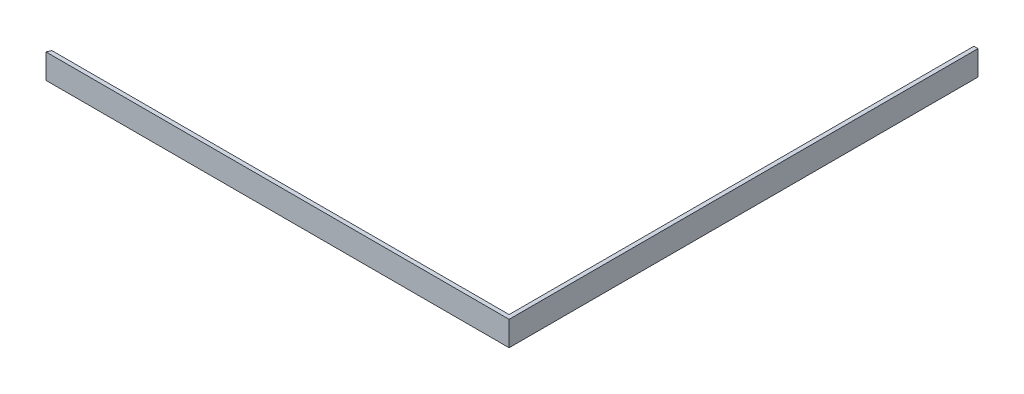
SolidWorks part; units mm, degrees
ref_plane "Front Plane" through (0, 0, 0) normal (0, 0, 1) x (1, 0, 0)
ref_plane "Top Plane" through (0, 0, 0) normal (0, 1, 0) x (1, 0, 0)
ref_plane "Right Plane" through (0, 0, 0) normal (1, 0, 0) x (0, 0, -1)
sketch "Sketch1" plane through (0, 0, 0) normal (0, 0, 1) x (1, 0, 0)
  line L0 (0, 38.1) -> (0, 0)
  line L1 (0, 0) -> (6.35, 0) construction
  line L3 (0, 38.1) -> (6.35, 38.1)
  line L5 (0, 0) -> (6.35, 38.1) construction
  line L6 (0, 38.1) -> (6.35, 0) construction
  line L7 (0, 0) -> (6.35, 0)
  line L8 (6.35, 0) -> (6.35, 38.1)
  point P1 (0, 0)
  point P4 (3.175, 19.05)
  point P7 (0, 0)
  dimension "D1" = 6.35
  dimension "D2" = 38.1
extrude "Boss-Extrude1" add sketch "Sketch1" along normal blind 717.55
sketch "Sketch2" plane through (0, 0, 0) normal (-1, 0, 0) x (0, 0, 1)
  line L1 (717.55, 0) -> (723.9, 0)
  line L2 (717.55, 0) -> (717.55, 38.1)
  line L3 (717.55, 38.1) -> (723.9, 38.1)
  line L4 (723.9, 0) -> (723.9, 38.1)
  line L5 (717.55, 0) -> (723.9, 38.1) construction
  line L6 (717.55, 38.1) -> (723.9, 0) construction
  point P4 (720.725, 19.05)
  dimension "D1" = 6.35
  dimension "D2" = 38.1
extrude "Boss-Extrude2" add sketch "Sketch2" along normal blind 711.2 separate body
sketch "Sketch3" plane through (0, 0, 0) normal (1, 0, 0) x (0, 0, -1)
  line L4 (-717.55, 0) -> (-717.55, 38.1)
  line L5 (-717.55, 38.1) -> (-723.9, 38.1)
  line L6 (-723.9, 38.1) -> (-723.9, 0)
  line L7 (-723.9, 0) -> (-717.55, 0)
  line L8 (-717.55, 0) -> (-717.55, 38.1)
  line L9 (-717.55, 38.1) -> (-723.9, 38.1)
  line L10 (-723.9, 38.1) -> (-723.9, 0)
  line L11 (-723.9, 0) -> (-717.55, 0)
  dimension "D1" = 0
extrude "Boss-Extrude3" add sketch "Sketch3" along normal up to surface (6.35 mm away)
sketch "Sketch5" plane through (0, 0, 0) normal (0, -1, 0) x (1, 0, 0)
  line L0 (-711.2, 723.9) -> (-711.2, 717.55)
  line L1 (-711.2, 717.55) -> (-705.9395, 717.55)
  line L2 (-705.9395, 717.55) -> (-708.6349, 723.9)
  line L3 (-708.6349, 723.9) -> (-711.2, 723.9)
  line L4 (6.35, 723.9) -> (-711.2, 723.9) construction
  line L5 (-711.2, 717.55) -> (-711.2, 723.9) construction
  line L8 (-711.2, 717.55) -> (0, 717.55) construction
  point P10 (-709.0377, 723.9)
  dimension "D1" = 113
  dimension "D3" = 5.2605
extrude "Cut-Extrude2" cut sketch "Sketch5" against normal through all
